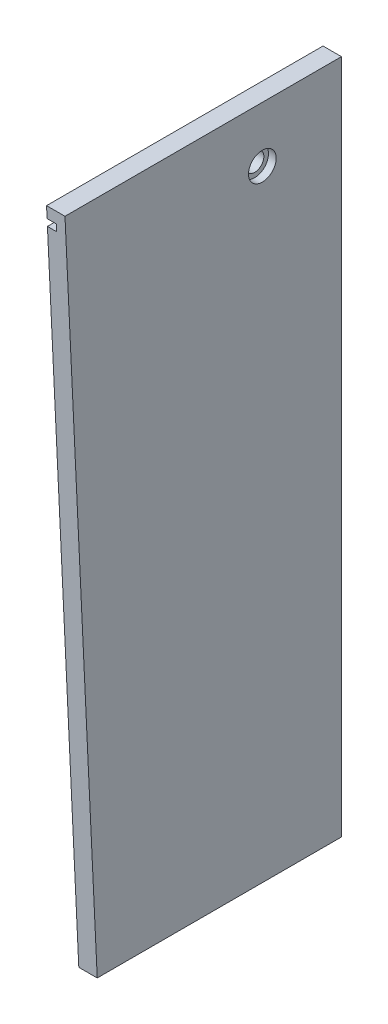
SolidWorks part; units mm, degrees
ref_plane "Front Plane" through (0, 0, 0) normal (0, 0, 1) x (1, 0, 0)
ref_plane "Top Plane" through (0, 0, 0) normal (0, 1, 0) x (1, 0, 0)
ref_plane "Right Plane" through (0, 0, 0) normal (1, 0, 0) x (0, 0, -1)
sketch "Sketch1" plane through (0, 0, 0) normal (1, 0, 0) x (0, 0, -1)
  line L0 (0, 0) -> (0, -698.5)
  line L1 (0, 0) -> (-285.75, 0)
  line L2 (0, -698.5) -> (-252.4125, -698.5)
  line L3 (-285.75, 0) -> (-252.4125, -698.5)
  dimension "D1" = 285.75
  dimension "D2" = 698.5
  dimension "D3" = 252.4125
extrude "Boss-Extrude1" add sketch "Sketch1" against normal blind 19.05
sketch "Sketch2" plane through (0, 0, 0) normal (0, 0, -1) x (-1, 0, 0)
  line L0 (19.05, -698.5) -> (19.05, 0) construction
  line L1 (19.05, -11.9063) -> (9.525, -11.9063)
  line L2 (19.05, -11.9063) -> (19.05, -19.05)
  line L3 (19.05, -19.05) -> (9.525, -19.05)
  line L4 (9.525, -11.9063) -> (9.525, -19.05)
  line L5 (19.05, 0) -> (0, 0) construction
  dimension "D1" = 11.9062
  dimension "D2" = 7.1437
  dimension "D3" = 9.525
extrude "Cut-Extrude1" cut sketch "Sketch2" against normal through all
sketch "Sketch3" plane through (-19.05, 0, 0) normal (-1, 0, 0) x (0, 0, 1)
  line L0 (0, -698.5) -> (0, -19.05) construction
  line L1 (0, -679.45) -> (230.5399, -679.45)
  line L2 (0, -679.45) -> (0, -686.5938)
  line L3 (0, -686.5938) -> (230.5399, -686.5938)
  line L4 (230.5399, -679.45) -> (230.5399, -686.5938) construction
  line L5 (252.4125, -698.5) -> (0, -698.5) construction
  line L6 (0, -698.5) -> (0, -19.05) construction
  arc A0 (230.5399, -679.45) -> (230.5399, -686.5938) centre (230.5399, -683.0219) cw
  dimension "D1" = 234.1118
  dimension "D2" = 7.1437
  dimension "D3" = 11.9062
extrude "Cut-Extrude2" cut sketch "Sketch3" against normal blind 9.525
sketch "Sketch4" plane through (0, 0, 0) normal (1, 0, 0) x (0, 0, -1)
  line L0 (0, 0) -> (-285.75, 0) construction
  line L1 (0, -698.5) -> (0, 0) construction
  circle A0 centre (-81.7562, -57.15) radius 9.525
  dimension "D1" = 19.05
  dimension "D2" = 57.15
  dimension "D3" = 81.7562
extrude "Cut-Extrude3" cut sketch "Sketch4" against normal through all
sketch "Sketch5" plane through (0, 0, 0) normal (1, 0, 0) x (0, 0, -1)
  circle A2 centre (-81.7562, -57.15) radius 14.2875
  circle A3 centre (-81.7562, -57.15) radius 14.2875
  dimension "D1" = 4.7625
extrude "Cut-Extrude4" cut sketch "Sketch5" against normal blind 7.9375
sketch "Sketch6" plane through (0, 0, 0) normal (0, 0, -1) x (-1, 0, 0)
  line L0 (19.05, -698.5) -> (0, -698.5) construction
  line L1 (9.525, -11.9063) -> (60.325, -11.9063)
  line L2 (9.525, -11.9063) -> (9.525, -698.5)
  line L3 (9.525, -698.5) -> (60.325, -698.5)
  line L4 (60.325, -11.9063) -> (60.325, -698.5)
  dimension "D1" = 50.8
extrude "Cut-Extrude5" cut sketch "Sketch6" against normal blind 12.7
sketch "Sketch7" plane through (-19.05, 0, 0) normal (-1, 0, 0) x (0, 0, 1)
  line L0 (12.7, -236.5375) -> (166.6875, -236.5375) construction
  line L1 (12.7, -679.45) -> (12.7, -19.05) construction
  line L2 (12.7, -528.6375) -> (166.6875, -528.6375) construction
  line L3 (166.6875, -236.5375) -> (166.6875, -528.6375) construction
  line L4 (136.525, -236.5375) -> (136.525, -528.6375) construction
  line L5 (60.325, -236.5375) -> (60.325, -528.6375) construction
  line L6 (230.5399, -679.45) -> (12.7, -679.45) construction
  circle A0 centre (60.325, -236.5375) radius 1.5875
  circle A1 centre (136.525, -236.5375) radius 1.5875
  circle A2 centre (166.6875, -236.5375) radius 1.5875
  circle A3 centre (166.6875, -528.6375) radius 1.5875
  circle A4 centre (136.525, -528.6375) radius 1.5875
  circle A5 centre (60.325, -528.6375) radius 1.5875
  dimension "D1" = 3.175
  dimension "D2" = 30.1625
  dimension "D3" = 47.625
  dimension "D4" = 76.2
  dimension "D5" = 292.1
  dimension "D6" = 150.8125
extrude "Cut-Extrude6" cut sketch "Sketch7" against normal blind 6.35
